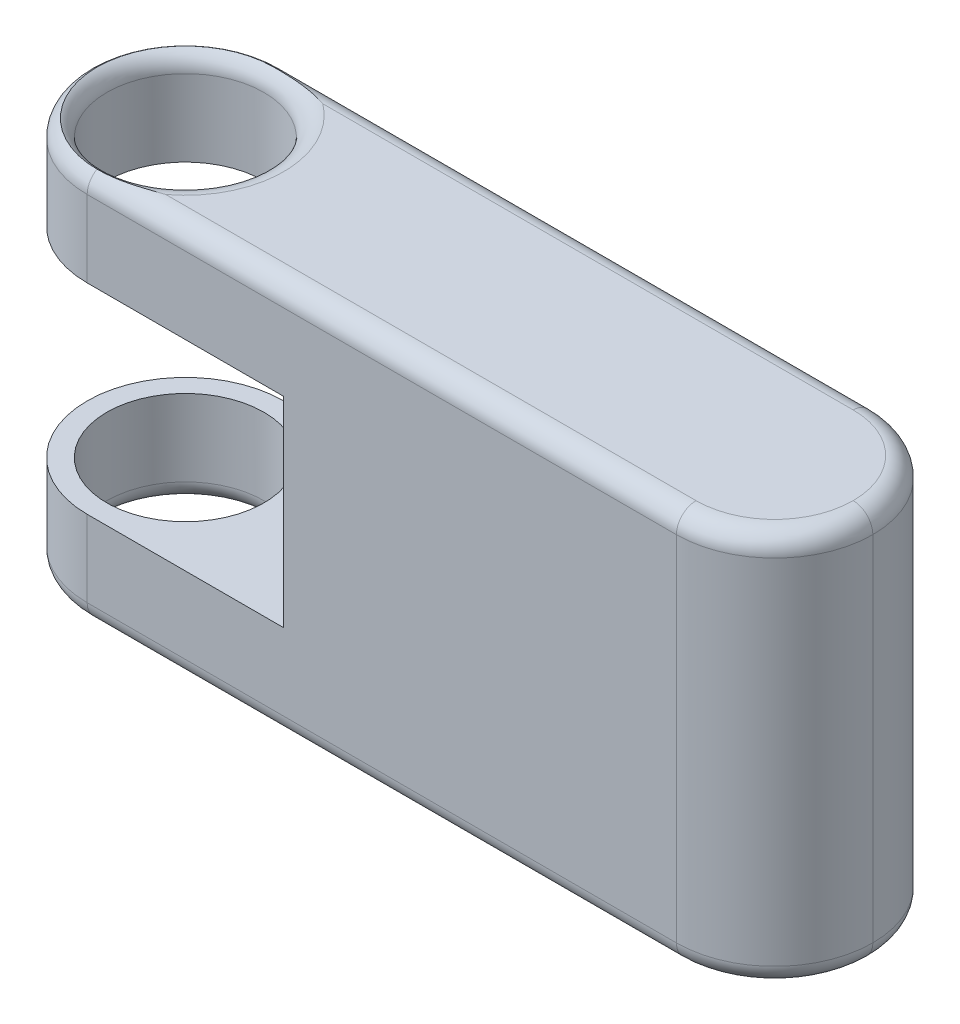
SolidWorks part; units mm, degrees
ref_plane "Piano frontale" through (0, 0, 0) normal (0, 0, 1) x (1, 0, 0)
ref_plane "Piano superiore" through (0, 0, 0) normal (0, 1, 0) x (1, 0, 0)
ref_plane "Piano destro" through (0, 0, 0) normal (1, 0, 0) x (0, 0, -1)
sketch "Schizzo3" plane through (0, 0, 0) normal (0, 0, 1) x (1, 0, 0)
  line L0 (0, 0) -> (400, 0)
  line L1 (400, 0) -> (400, -200)
  line L2 (400, -200) -> (0, -200)
  line L3 (0, -200) -> (0, -151)
  line L4 (0, -151) -> (150, -151)
  line L5 (150, -151) -> (150, -49)
  line L6 (150, -49) -> (0, -49)
  line L7 (0, -49) -> (0, 0)
  dimension "D1" = 400
  dimension "D2" = 49
  dimension "D3" = 49
  dimension "D4" = 200
  dimension "D5" = 150
extrude "Estrusione-Estrusione1" add sketch "Schizzo3" along normal blind 100
sketch "Schizzo4" plane through (0, 0, 0) normal (0, 1, 0) x (1, 0, 0)
  line L0 (50, 0) -> (50, -100) construction
  line L2 (400, 0) -> (0, 0) construction
  line L3 (400, -100) -> (0, -100) construction
  line L4 (0, -100) -> (0, 0) construction
  line L5 (0, -50) -> (400, -50) construction
  line L6 (400, -100) -> (400, 0) construction
  circle A0 centre (50, -50) radius 40
  dimension "D2" = 80
  dimension "D1" = 50
extrude "Taglio-Estrusione1" cut sketch "Schizzo4" against normal blind 200
ref_plane "Piano1" through (0, 0, 100) normal (0, 0, -1) x (-1, 0, 0)
fillet "Raccordo10" radius 50 1 edges at (0, -175.5, 100)
fillet "Raccordo11" radius 50 1 edges at (0, -24.5, 100)
fillet "Raccordo12" radius 50 1 edges at (0, -175.5, 0)
fillet "Raccordo13" radius 50 1 edges at (0, -24.5, 0)
move or copy body "Corpo-Sposta/copia1" bodies to move or copy 102 copy no rotation origin (0, -100, 100) rotation axis (1, 0, 0) rotation angle 90
move or copy body "Corpo-Sposta/copia2" bodies to move or copy 113 copy no rotation origin (0, -100, 100) rotation axis (-1, 0, 0) rotation angle 90
fillet "Raccordo14" radius 50 1 edges at (400, -100, 100)
fillet "Raccordo15" radius 50 1 edges at (400, -100, 0)
fillet "Raccordo16" radius 10 14 edges at (200, 0, 100) (14.6447, 0, 85.3553) (14.6447, 0, 14.6447) (200, 0, 0) (385.3553, 0, 14.6447) (385.3553, 0, 85.3553) (50, 0, 90) (14.6447, -200, 14.6447) (14.6447, -200, 85.3553) (200, -200, 100) (385.3553, -200, 85.3553) (385.3553, -200, 14.6447) (200, -200, 0) (50, -200, 90)
